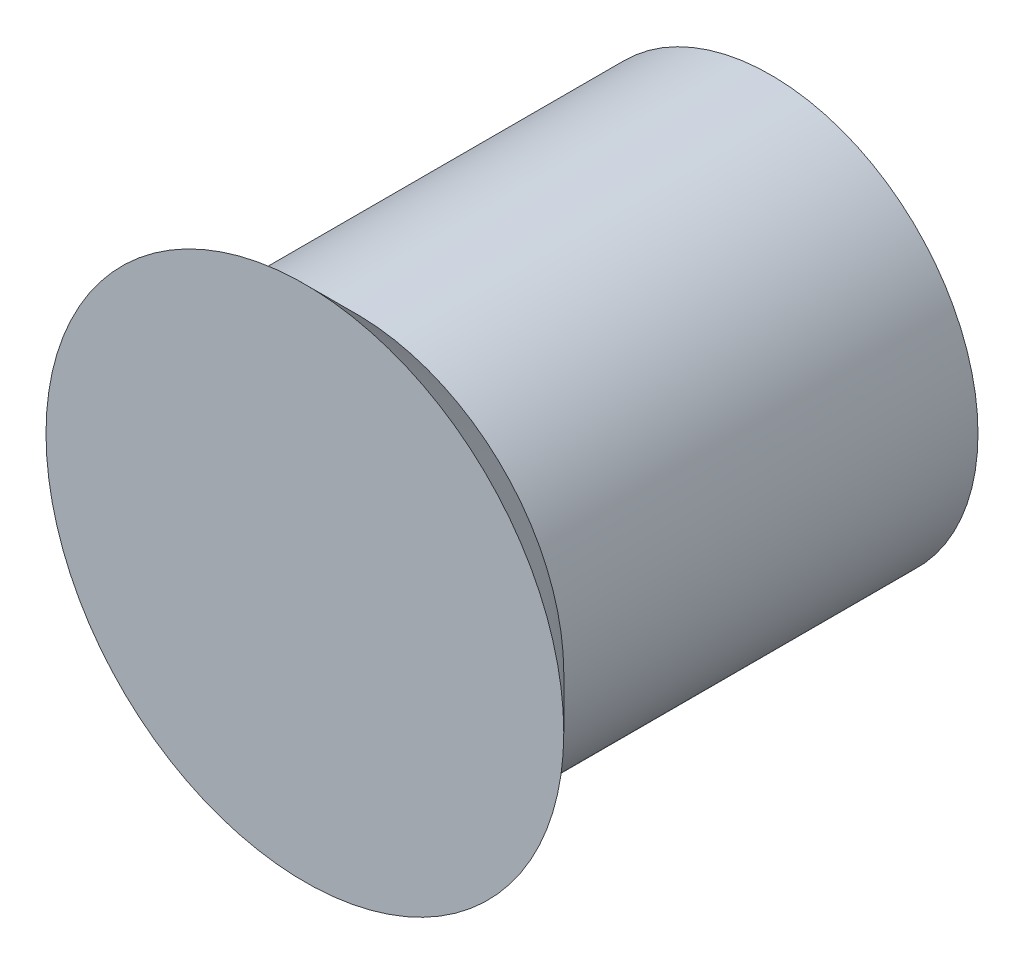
SolidWorks part; units mm, degrees
ref_plane "Ön Düzlem" through (0, 0, 0) normal (0, 0, 1) x (1, 0, 0)
ref_plane "Üst Düzlem" through (0, 0, 0) normal (0, 1, 0) x (1, 0, 0)
ref_plane "Sağ Düzlem" through (0, 0, 0) normal (1, 0, 0) x (0, 0, -1)
sketch "Çizim1" plane through (0, 0, 0) normal (0, 0, 1) x (1, 0, 0)
  circle A0 centre (0, 0) radius 4
  dimension "D1" = 8
extrude "Yükseklik-Ekstrüzyon1" add sketch "Çizim1" along normal blind 8
sketch "Çizim2" plane through (0, 0, 8) normal (0, 0, 1) x (1, 0, 0)
  circle A0 centre (0, 0) radius 4
extrude "Yükseklik-Ekstrüzyon2" add sketch "Çizim2" along normal blind 1 draft 45
